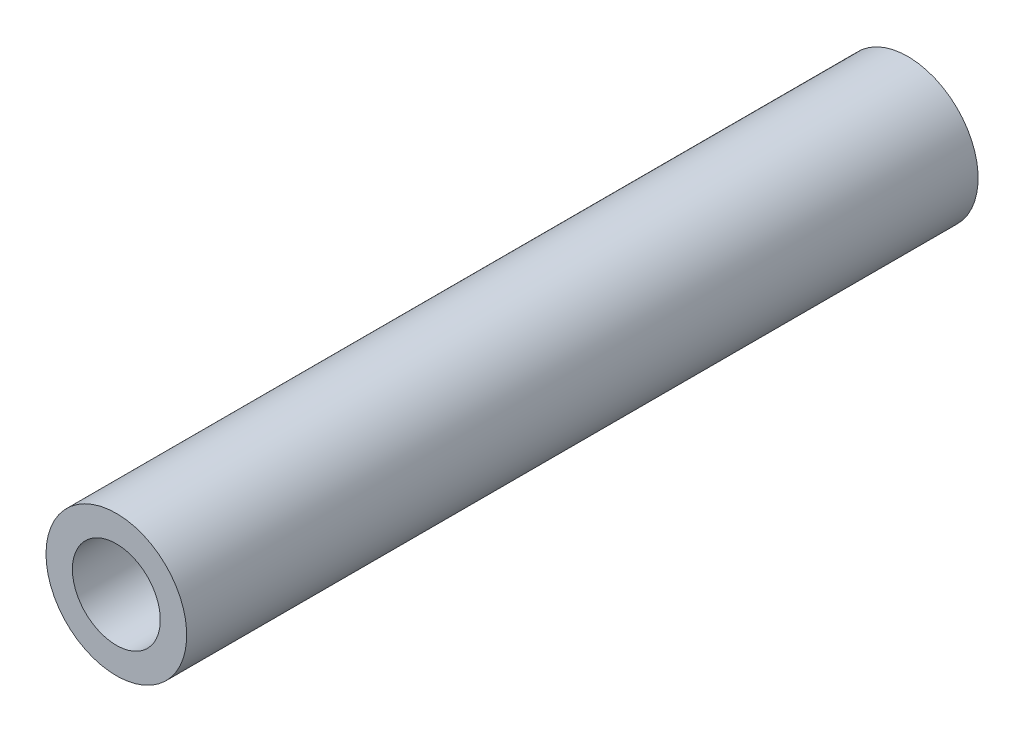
SolidWorks part; units mm, degrees
ref_plane "Plan1" through (0, 0, 0) normal (0, 0, 1) x (1, 0, 0)
ref_plane "Plan2" through (0, 0, 0) normal (0, 1, 0) x (1, 0, 0)
ref_plane "Plan3" through (0, 0, 0) normal (1, 0, 0) x (0, 0, -1)
sketch "Esquisse1" plane through (0, 0, 0) normal (0, 0, 1) x (1, 0, 0)
  circle A0 centre (0, 0) radius 4
  circle A1 centre (0, 0) radius 2.5
  dimension "D1" = 8
  dimension "D2" = 5
extrude "Base-Extrusion" add sketch "Esquisse1" along normal blind 45
